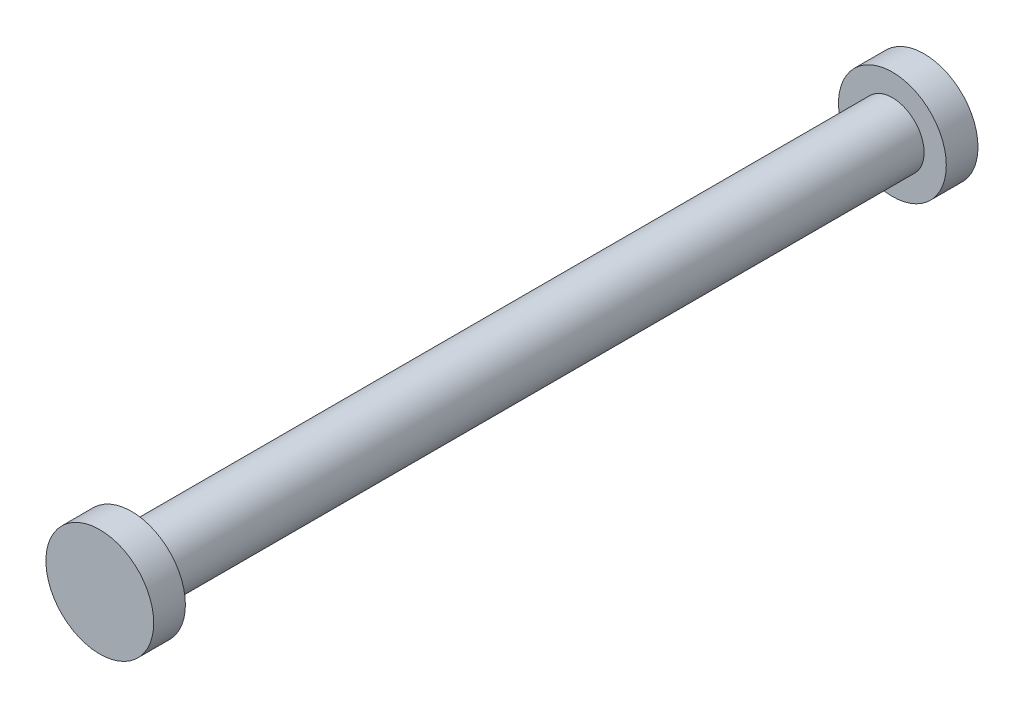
SolidWorks part; units mm, degrees
ref_plane "Alzado" through (0, 0, 0) normal (0, 0, 1) x (1, 0, 0)
ref_plane "Planta" through (0, 0, 0) normal (0, 1, 0) x (1, 0, 0)
ref_plane "Vista lateral" through (0, 0, 0) normal (1, 0, 0) x (0, 0, -1)
sketch3d "Sk_Eje"
  line L0 (-425.1, 65, -65) -> (-425.1, 65, 65)
sweep "Eje" add path "Sk_Eje" parameters "D3"=10
sketch3d "Sk_Tuerca_dcha"
  line L0 (-425.1, 65, 60) -> (-425.1, 65, 65)
sweep "Tuerca_dcha" add path "Sk_Tuerca_dcha" parameters "D3"=17
sketch3d "Sk_Tuerca_izq"
  line L0 (-425.1, 65, -65) -> (-425.1, 65, -60)
sweep "Tuerca_izq" add path "Sk_Tuerca_izq" parameters "D3"=17
